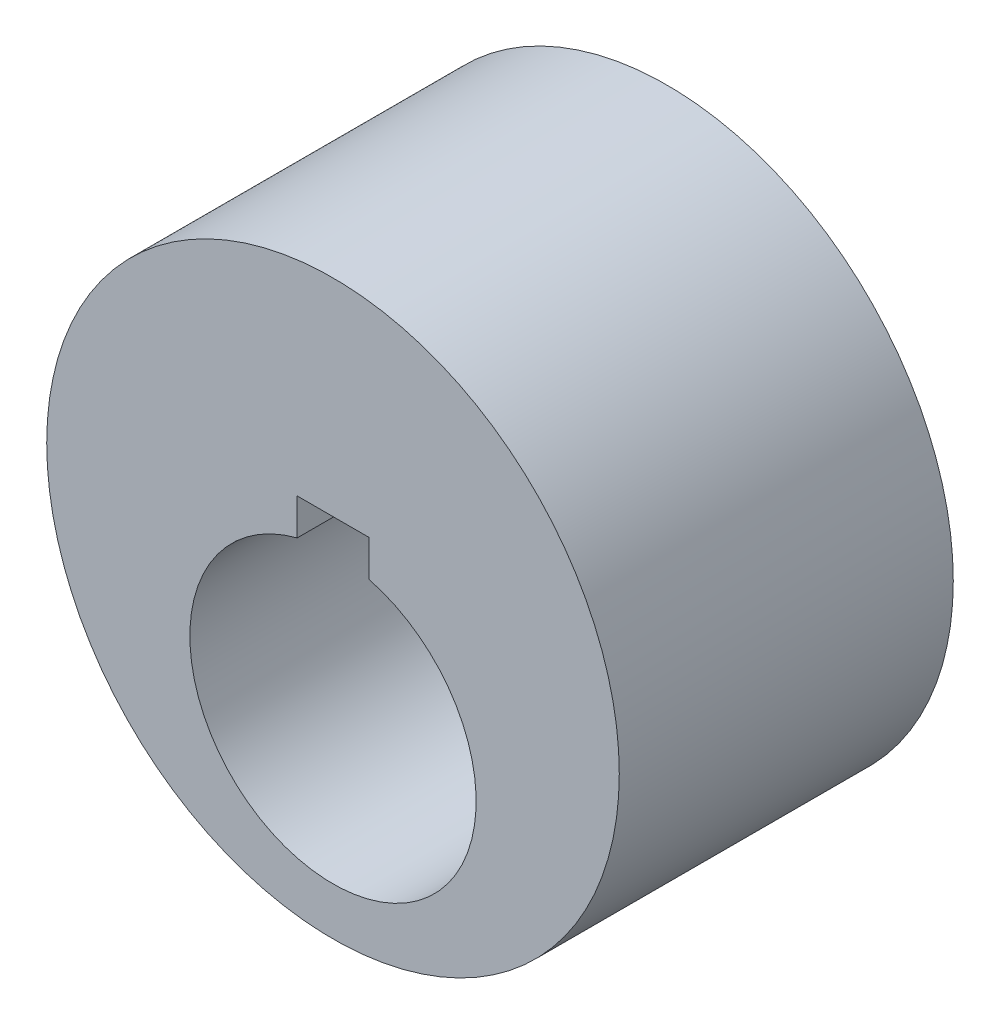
SolidWorks part; units mm, degrees
ref_plane "Plan de face" through (0, 0, 0) normal (0, 0, 1) x (1, 0, 0)
ref_plane "Plan de dessus" through (0, 0, 0) normal (0, 1, 0) x (1, 0, 0)
ref_plane "Plan de droite" through (0, 0, 0) normal (1, 0, 0) x (0, 0, -1)
ref_plane "Plan4" through (0, 12, 0) normal (0, -1, 0) x (1, 0, 0)
sketch "Esquisse1" plane through (0, 12, 0) normal (0, -1, 0) x (1, 0, 0)
  line L0 (36, 42) -> (0, 42)
  line L1 (0, 42) -> (0, 0)
  line L2 (0, 0) -> (36, 0)
  line L3 (36, 0) -> (36, 42)
  line L4 (0, 42) -> (0, 0) construction
revolve "Révolution1" add sketch "Esquisse1" angle 360 about L4
sketch "Esquisse2" plane through (0, 0, 0) normal (0, 0, -1) x (-1, 0, 0)
  line L0 (4.5, 22) -> (-4.5, 22)
  line L1 (-4.5, 22) -> (-4.5, 17.4284)
  line L2 (4.5, 17.4284) -> (4.5, 22)
  arc A0 (-4.5, 17.4284) -> (4.5, 17.4284) centre (0, 0) cw
extrude "Enlèv. mat.-Extru.1" cut sketch "Esquisse2" against normal up to next
sketch "Esquisse3" plane through (0, 0, 0) normal (0, 1, 0) x (1, 0, 0)
  line L0 (18, 0) -> (0, 0)
  line L1 (0, 0) -> (0, -42)
  line L2 (0, -42) -> (18, -42)
  line L3 (18, -42) -> (18, 0)
  line L4 (0, 0) -> (0, -42) construction
revolve "Enlèvement de matière-Révolution1" cut sketch "Esquisse3" angle 360 about L4
hole_wizard "Diamètre du perçage M6.0 (6)1" positions "Esquisse5" profile "Esquisse4" hole size "M6.0" standard "Ansi Métrique"
sketch "Esquisse5" plane through (0, 0, 0) normal (0, 0, -1) x (-1, 0, 0)
  point P0 (0, 42)
sketch "Esquisse4" plane through (0, 42, 0) normal (1, 0, 0) x (0, 1, 0)
  line L0 (0, 0) -> (0, 15.7321)
  line L1 (0, 15.7321) -> (3, 14)
  line L2 (3, 14) -> (3, 0)
  line L5 (3, 0) -> (0, 0)
  line L10 (0, 15.7321) -> (-3, 14) construction
  line L11 (0, -6.35) -> (0, 107.95) construction
  dimension "Diamètre du perçage" = 6
  dimension "Profondeur du perçage" = 14
  dimension "Angle de pointe" = 120
